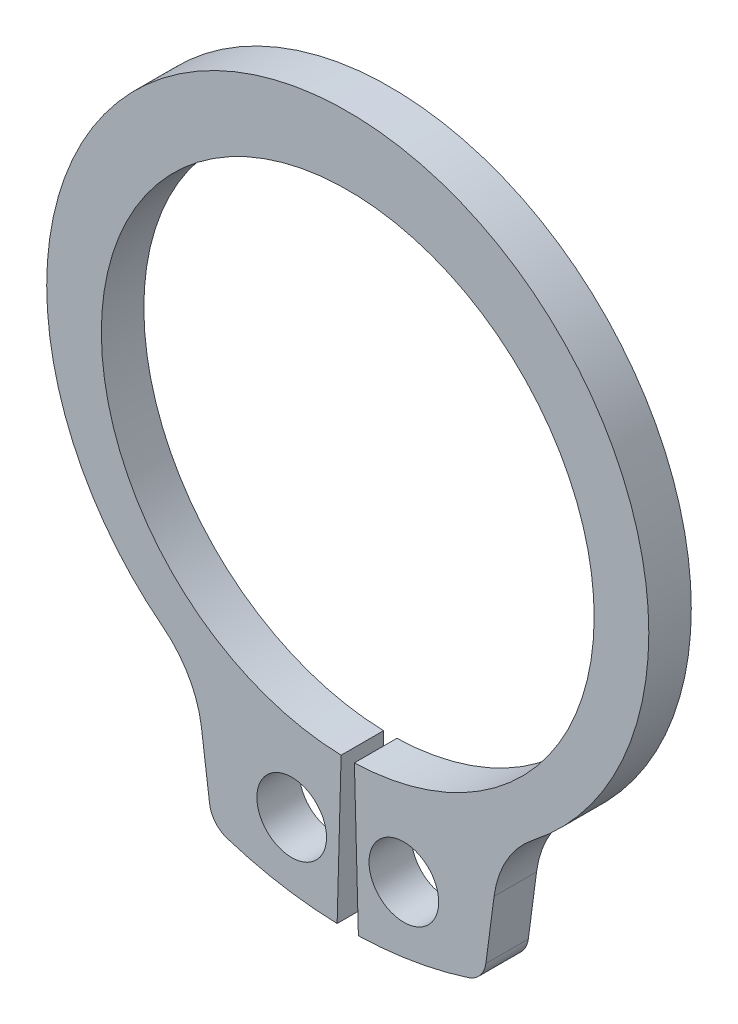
SolidWorks part; units mm, degrees
ref_plane "Plane1" through (0, 0, 0) normal (0, 0, 1) x (1, 0, 0)
ref_plane "Plane2" through (0, 0, 0) normal (0, 1, 0) x (1, 0, 0)
ref_plane "Plane3" through (0, 0, 0) normal (1, 0, 0) x (0, 0, -1)
extrude "Body" add sketch "BodySke" against normal blind 0.635
sketch "BodySke" plane through (0, 0, 0) normal (0, 0, 1) x (1, 0, 0)
  line L0 (-1.5431, 0) -> (1.5431, 0) construction
  line L1 (0, 0) -> (0, 4.699) construction
  line L2 (0.0992, -3.6817) -> (0.1588, -5.8907)
  line L3 (-0.0992, -3.6817) -> (-0.1588, -5.8907)
  line L4 (0, 0) -> (3.7224, -4.5682) construction
  line L5 (0, 0) -> (-3.7224, -4.5682) construction
  line L7 (2.1868, -4.366) -> (2.0642, -5.2972)
  line L8 (-2.1868, -4.366) -> (-2.0642, -5.2972)
  circle A0 centre (0, 0) radius 3.683 construction
  arc A1 (0.0992, -3.6817) -> (-0.0992, -3.6817) centre (0, 0) ccw
  arc A2 (2.7437, -3.3671) -> (-2.7437, -3.3671) centre (0, 0.1993) ccw construction
  arc A3 (0.1588, -5.8907) -> (1.803, -5.6102) centre (0, 0) ccw
  arc A4 (2.7692, -3.3473) -> (2.1868, -4.366) centre (3.7224, -4.5682) ccw
  arc A5 (-2.1868, -4.366) -> (-2.7692, -3.3473) centre (-3.7224, -4.5682) ccw
  arc A6 (-1.803, -5.6102) -> (-0.1588, -5.8907) centre (0, 0) ccw
  arc A7 (2.7692, -3.3473) -> (-2.7692, -3.3473) centre (0, 0.1993) ccw
  arc A8 (-2.1797, -4.4193) -> (2.1797, -4.4193) centre (0, 0) ccw construction
  circle A9 centre (0.8382, -4.8558) radius 0.5207
  circle A10 centre (-0.8382, -4.8558) radius 0.5207
  arc A11 (2.0642, -5.2972) -> (1.803, -5.6102) centre (1.6864, -5.2475) cw
  arc A12 (-2.0642, -5.2972) -> (-1.803, -5.6102) centre (-1.6864, -5.2475) ccw
  point P28 (2.0334, -5.5309)
  point P31 (-2.0334, -5.5309)
  dimension "GrooveDia" = 7.366
  dimension "D3" = 0.381
  dimension "LugRad" = 5.8928
  dimension "HoleOffsetRad" = 4.9276
  dimension "HoleDia" = 1.0414
  dimension "D2" = 15
  dimension "LargeRad" = 4.699
  dimension "SmallRad" = 4.3434
  dimension "Gap" = 0.3175
  dimension "SmallAngle" = 78.35
  dimension "HoleSpacing" = 1.6764
sketch "Clipboard" plane through (0, 0, 0) normal (0, 0, 1) x (1, 0, 0)
  line L0 (0, 0) -> (1.016, 0)
  line L1 (0, 0) -> (0, 0.6604)
  line L2 (0, 0) -> (0, -2.2098)
  circle A0 centre (0, 0) radius 0.5207
  circle A1 centre (0, 0) radius 3.9624
  dimension "HoleDia" = 1.0414
  dimension "ShaftDia" = 7.9248
  dimension "LargeSection" = 1.016
  dimension "SmallSection" = 0.6604
  dimension "LugSection" = 2.2098
sketch "NotSke" plane through (0, 0, 0) normal (0, 0, 1) x (1, 0, 0)
  line L0 (0.8382, -4.3351) -> (0.8382, -5.3765)
  line L1 (0.8382, -5.3765) -> (-0.8382, -5.3765)
  line L2 (-0.8382, -5.3765) -> (-0.8382, -4.3351)
  line L3 (-0.8382, -4.3351) -> (0.8382, -4.3351)
  circle A0 centre (0.8382, -4.8558) radius 0.5207 construction
  circle A1 centre (-0.8382, -4.8558) radius 0.5207 construction
extrude "Notch" [suppressed] cut sketch "NotSke" against normal through all
equation "' \"ShaftDia@Clipboard\" = 0.125"
equation "' \"Thickness@Body\" = 0.01"
equation "' \"GrooveDia@BodySke\" = 0.117"
equation "' \"LugSection@Clipboard\" = 0.046"
equation "' \"LargeSection@Clipboard\" = 0.018"
equation "' \"SmallSection@Clipboard\" = 0.011"
equation "' \"HoleDia@Clipboard\" = 0.026"
equation "' \"ShaftDia@Clipboard\" = 0.394"
equation "' \"Thickness@Body\" = 0.025"
equation "' \"GrooveDia@BodySke\" = 0.369"
equation "' \"LugSection@Clipboard\" = 0.087"
equation "' \"LargeSection@Clipboard\" = 0.052"
equation "' \"SmallSection@Clipboard\" = 0.031"
equation "' \"HoleDia@Clipboard\" = 0.041"
equation "\"Gap@BodySke\" =  \"Thickness@Body\" / 2"
equation "\"LargeRad@BodySke\" =  \"GrooveDia@BodySke\" / 2 +  \"LargeSection@Clipboard\""
equation "\"SmallRad@BodySke\" =  \"GrooveDia@BodySke\" / 2 +  \"SmallSection@Clipboard\""
equation "\"LugRad@BodySke\" = \"GrooveDia@BodySke\" / 2 + \"LugSection@Clipboard\""
equation "\"HoleOffsetRad@BodySke\" = (  \"ShaftDia@Clipboard\" / 2 + \"LugRad@BodySke\" ) / 2"
equation "\"HoleSpacing@BodySke\" = \"Gap@BodySke\"  * 2 +  \"HoleDia@Clipboard\""
equation "\"HoleDia@BodySke\" =  \"HoleDia@Clipboard\""
equation "\"SmallAngle@BodySke\" = atn(\"HoleSpacing@BodySke\" / 2 / sqr(\"HoleOffsetRad@BodySke\"  * \"HoleOffsetRad@BodySke\" - (\"HoleSpacing@BodySke\" / 2) * (\"HoleSpacing@BodySke\" / 2) ))  * 8 * ( 180 / 3.141593)"
